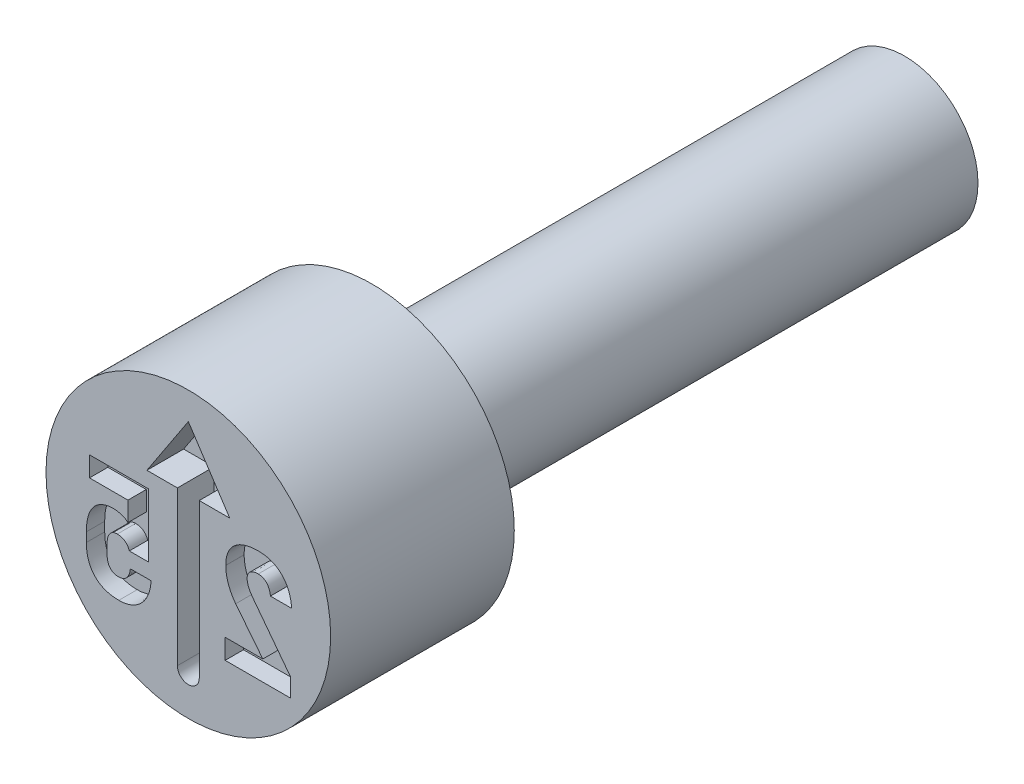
SolidWorks part; units mm, degrees
ref_plane "Front Plane" through (0, 0, 0) normal (0, 0, 1) x (1, 0, 0)
ref_plane "Top Plane" through (0, 0, 0) normal (0, 1, 0) x (1, 0, 0)
ref_plane "Right Plane" through (0, 0, 0) normal (1, 0, 0) x (0, 0, -1)
sketch "Sketch2" plane through (0, 0, 0) normal (1, 0, 0) x (0, 0, -1)
  line L0 (0.4039, 0) -> (50000.4039, 0) construction
  line L6 (0, 1.55) -> (0, 0)
  line L7 (2, 1.55) -> (0, 1.55)
  line L8 (2, 0.8) -> (2, 1.55)
  line L9 (7.8, 0.8) -> (2, 0.8)
  line L10 (7.8, 0) -> (7.8, 0.8)
  line L11 (0, 0) -> (7.8, 0)
  dimension "D1" = 3.1
  dimension "D2" = 1.6
  dimension "D3" = 7.8
  dimension "D4" = 2
revolve "Revolve1" add sketch "Sketch2" angle 360 about L0
sketch "Sketch3" plane through (0, 0, 0) normal (0, 0, 1) x (1, 0, 0)
  line L0 (0, 0) -> (0, 62500) construction
  line L1 (0.119, 0.5665) -> (0.119, -1.1101)
  line L2 (0.4512, 0.5665) -> (0.119, 0.5665)
  line L3 (0, 1.2513) -> (0.4512, 0.5665)
  line L15 (0, 1.2513) -> (-0.4512, 0.5665)
  line L16 (-0.4512, 0.5665) -> (-0.119, 0.5665)
  line L17 (-0.119, 0.5665) -> (-0.119, -1.1101)
  arc A2 (-0.119, -1.1101) -> (0.119, -1.1101) centre (0, -1.1101) ccw
extrude "Cut-Extrude4" cut sketch "Sketch3" against normal blind 0.4
sketch "Sketch4" plane through (0, 0, 0) normal (0, 0, 1) x (1, 0, 0)
  text T0 "2  5" font "Bahnschrift" height 1.2
  dimension "D1" = 0.8
  dimension "D2" = 1.2
extrude "Cut-Extrude5" cut sketch "Sketch4" against normal blind 0.2
